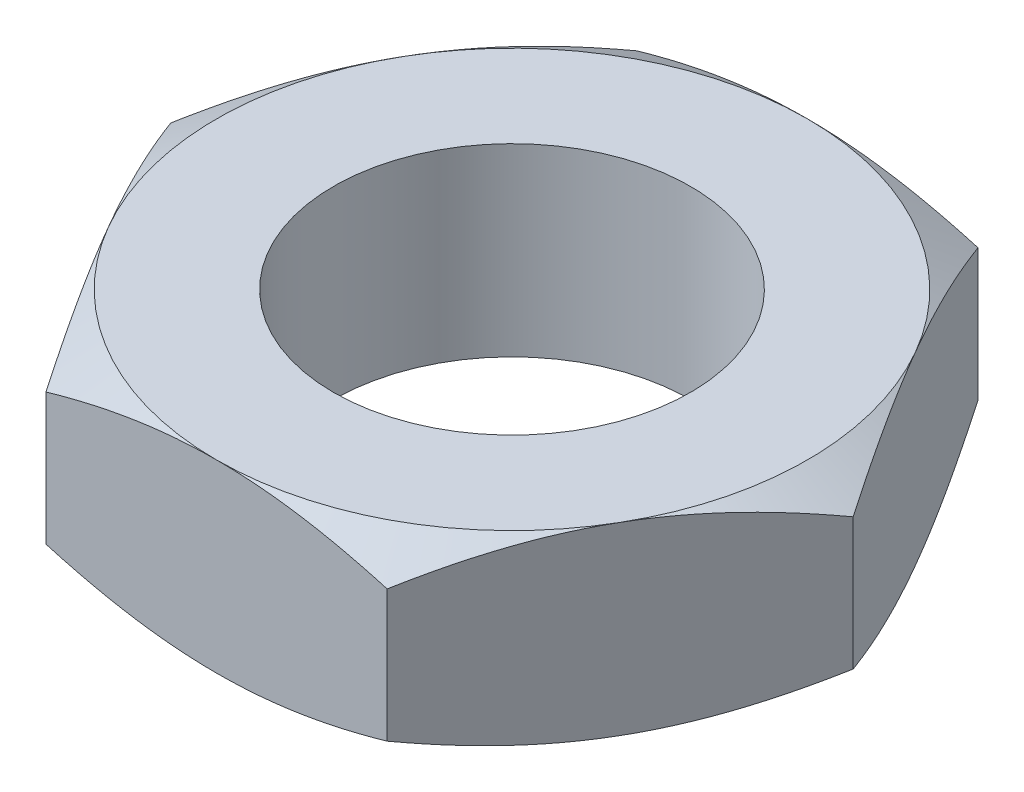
SolidWorks part; units mm, degrees
ref_plane "Front" through (0, 0, 0) normal (0, 0, 1) x (1, 0, 0)
ref_plane "Top" through (0, 0, 0) normal (0, 1, 0) x (1, 0, 0)
ref_plane "Right" through (0, 0, 0) normal (1, 0, 0) x (0, 0, -1)
sketch "Sketch1" plane through (0, 0, 0) normal (0, 1, 0) x (1, 0, 0)
  line L1 (6.9282, -12) -> (13.8564, 0)
  line L2 (13.8564, 0) -> (6.9282, 12)
  line L3 (6.9282, 12) -> (-6.9282, 12)
  line L4 (-6.9282, 12) -> (-13.8564, 0)
  line L5 (-13.8564, 0) -> (-6.9282, -12)
  line L6 (-6.9282, -12) -> (6.9282, -12)
  circle A0 centre (0, 0) radius 12 construction
  dimension "D1" = 24
extrude "Boss-Extrude1" add sketch "Sketch1" along normal blind 7.5
hole_wizard "M16x1.5 Tapped Hole1" positions "Sketch3" profile "Sketch4" tap size "M16x1.5" standard "ANSI Metric"
sketch "Sketch3" plane through (0, 7.5, 0) normal (0, 1, 0) x (1, 0, 0)
  point P0 (0, 0)
sketch "Sketch4" plane through (0, 7.5, 0) normal (1, 0, 0) x (0, 0, 1)
  line L0 (0, 0) -> (0, 7.5)
  line L1 (0, 7.5) -> (7.25, 7.5)
  line L2 (7.25, 7.5) -> (7.25, 0)
  line L5 (7.25, 0) -> (0, 0)
  line L11 (0, -6.35) -> (0, 107.95) construction
  dimension "Thru Tap Drill Dia." = 14.5
  dimension "Thru Tap Drill Depth" = 7.5
sketch "Sketch5" plane through (0, 7.5, 0) normal (0, 1, 0) x (1, 0, 0)
  line L0 (13.8564, 0) -> (6.9282, 12) construction
  circle A0 centre (0, 0) radius 12
extrude "Cut-Extrude1" cut sketch "Sketch5" against normal blind 7.5 draft 60 flip side to cut
sketch "Sketch6" plane through (0, 0, 0) normal (0, -1, 0) x (1, 0, 0)
  line L0 (6.9282, 12) -> (13.8564, 0) construction
  circle A0 centre (0, 0) radius 12
extrude "Cut-Extrude3" cut sketch "Sketch6" against normal blind 7.5 draft 60 flip side to cut contours A0
